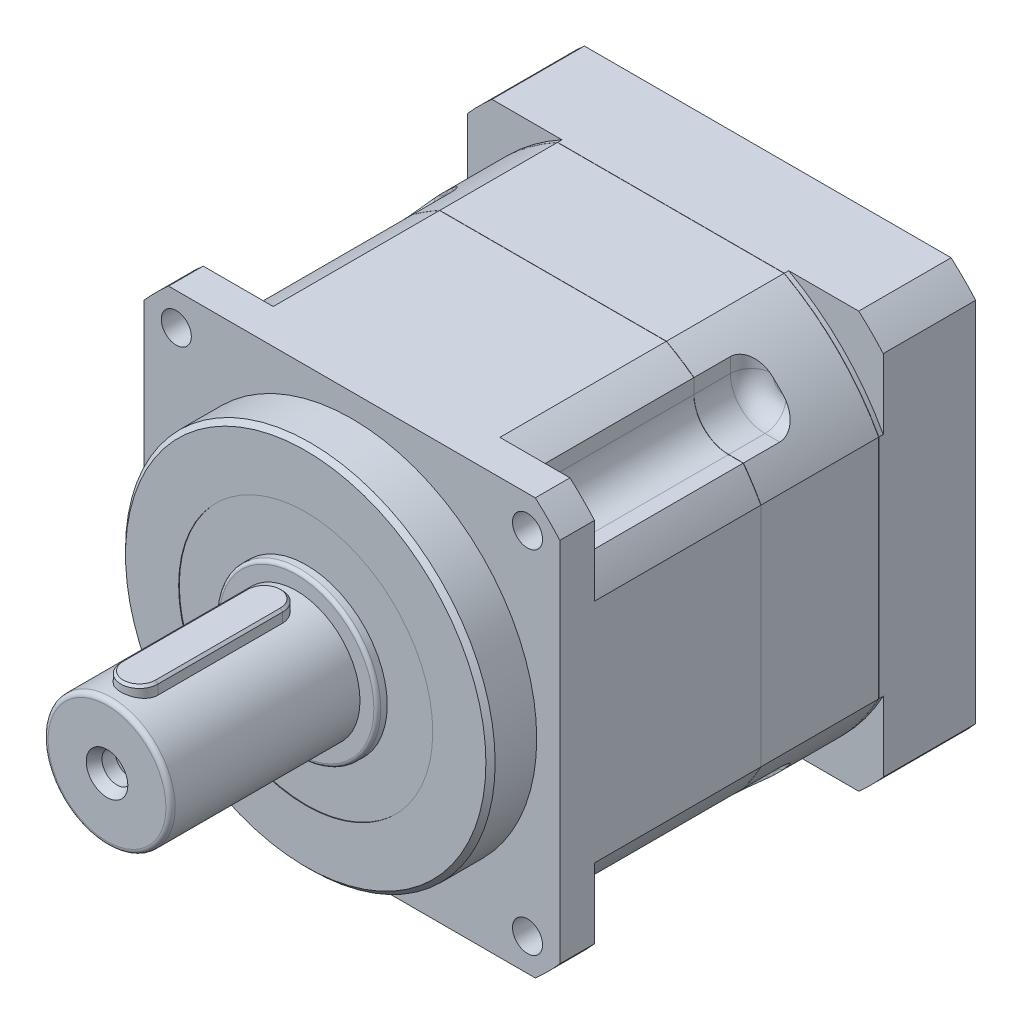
SolidWorks part; units mm, degrees
ref_plane "前视基准面" through (0, 0, 0) normal (0, 0, 1) x (1, 0, 0)
ref_plane "上视基准面" through (0, 0, 0) normal (0, 1, 0) x (1, 0, 0)
ref_plane "右视基准面" through (0, 0, 0) normal (1, 0, 0) x (0, 0, -1)
sketch "草图1" plane through (0, 0, 0) normal (0, 0, 1) x (1, 0, 0)
  line L1 (-79.3725, 90) -> (79.3725, 90)
  line L2 (-90, 79.3725) -> (-90, -79.3725)
  line L3 (-79.3725, -90) -> (79.3725, -90)
  line L4 (90, 79.3725) -> (90, -79.3725)
  arc A0 (-79.3725, 90) -> (-90, 79.3725) centre (0, 0) ccw
  arc A1 (90, 79.3725) -> (79.3725, 90) centre (0, 0) ccw
  arc A2 (79.3725, -90) -> (90, -79.3725) centre (0, 0) ccw
  arc A3 (-90, -79.3725) -> (-79.3725, -90) centre (0, 0) ccw
  dimension "D1" = 90
  dimension "D3" = 90
extrude "凸台-拉伸1" add sketch "草图1" along normal blind 15
sketch "草图2" plane through (0, 0, 15) normal (0, 0, 1) x (1, 0, 0)
  circle A0 centre (0, 0) radius 80
extrude "凸台-拉伸2" add sketch "草图2" along normal blind 20
sketch "草图3" plane through (0, 0, 0) normal (0, 0, -1) x (-1, 0, 0)
  line L0 (-79.3725, 90) -> (79.3725, 90) construction
  line L1 (90, 79.3725) -> (90, -79.3725) construction
  line L2 (79.3725, -90) -> (-79.3725, -90) construction
  line L3 (-90, -79.3725) -> (-90, 79.3725) construction
  line L4 (-49.0535, 90) -> (49.0535, 90)
  line L5 (90, 49.0535) -> (90, -49.0535)
  line L6 (49.0535, -90) -> (-49.0535, -90)
  line L7 (-90, -49.0535) -> (-90, 49.0535)
  arc A0 (-49.0535, 90) -> (-90, 49.0535) centre (0, 0) ccw
  arc A1 (-90, -49.0535) -> (-49.0535, -90) centre (0, 0) ccw
  arc A2 (49.0535, -90) -> (90, -49.0535) centre (0, 0) ccw
  arc A3 (90, 49.0535) -> (49.0535, 90) centre (0, 0) ccw
extrude "凸台-拉伸3" add sketch "草图3" along normal blind 72
sketch "草图4" plane through (0, 0, -72) normal (0, 0, -1) x (-1, 0, 0)
  line L1 (-104.8113, 97.2781) -> (-61, 97.2781)
  line L2 (-104.8113, 97.2781) -> (-104.8113, 61)
  line L3 (-104.8113, 61) -> (-61, 61)
  line L4 (-61, 97.2781) -> (-61, 61)
  dimension "D1" = 61
  dimension "D2" = 61
extrude "切除-拉伸1" cut sketch "草图4" against normal up to surface (72 mm away)
pattern_circular "阵列(圆周)1" count 4 over 360 about axis through (0, 0, 0) along (0, 0, 1) of "切除-拉伸1"
fillet "圆角1" radius 15 4 edges at (61, -61, -36) (-61, -61, -36) (-61, 61, -36) (61, 61, -36)
ref_plane "基准面1" through (0, 0, -72.1) normal (0, 0, -1) x (-1, 0, 0)
sketch "草图5" plane through (0, 0, -72.1) normal (0, 0, -1) x (-1, 0, 0)
  line L1 (-49.0535, 90) -> (49.0535, 90)
  line L2 (-90, 49.0535) -> (-90, -49.0535)
  line L3 (-49.0535, -90) -> (49.0535, -90)
  line L4 (90, 49.0535) -> (90, -49.0535)
  arc A0 (-49.0535, 90) -> (-90, 49.0535) centre (0, 0) ccw
  arc A1 (-90, -49.0535) -> (-49.0535, -90) centre (0, 0) ccw
  arc A2 (49.0535, -90) -> (90, -49.0535) centre (0, 0) ccw
  arc A3 (90, 49.0535) -> (49.0535, 90) centre (0, 0) ccw
  dimension "D1" = 90
  dimension "D3" = 90
extrude "凸台-拉伸4" add sketch "草图5" along normal blind 50.9 separate body
sketch "草图7" plane through (0, 0, -72.1) normal (0, 0, 1) x (1, 0, 0)
  line L0 (61, 76) -> (61, 82.3726) construction
  line L1 (82.3726, 61) -> (76, 61) construction
  line L2 (61, 76) -> (61, 82.3726)
  line L3 (82.3726, 61) -> (76, 61)
  arc A0 (61, 76) -> (76, 61) centre (76, 76) ccw construction
  arc A1 (61, 76) -> (76, 61) centre (76, 76) ccw
  arc A2 (82.3726, 61) -> (61, 82.3726) centre (0, 0) ccw
extrude "切除-拉伸2" cut sketch "草图7" against normal blind 24.9
pattern_circular "阵列(圆周)2" count 4 over 360 about axis through (0, 0, 0) along (0, 0, 1) of "切除-拉伸2"
fillet "圆角2" radius 9.2 12 edges at (79.1863, -61, -97) (61, -79.1863, -97) (-61, -79.1863, -97) (-79.1863, -61, -97) (-79.1863, 61, -97) (-61, 79.1863, -97) (61, 79.1863, -97) (79.1863, 61, -97) (65.3934, -65.3934, -97) (-65.3934, -65.3934, -97) (-65.3934, 65.3934, -97) (65.3934, 65.3934, -97)
ref_plane "基准面2" through (0, 0, -123.1) normal (0, 0, -1) x (-1, 0, 0)
sketch "草图8" plane through (0, 0, -123.1) normal (0, 0, -1) x (-1, 0, 0)
  line L0 (49.0535, 90) -> (-49.0535, 90) construction
  line L1 (-90, 49.0535) -> (-90, -49.0535) construction
  line L2 (-49.0535, -90) -> (49.0535, -90) construction
  line L3 (90, -49.0535) -> (90, 49.0535) construction
  line L4 (49.0535, 90) -> (-49.0535, 90)
  line L5 (-90, 49.0535) -> (-90, -49.0535)
  line L6 (-49.0535, -90) -> (49.0535, -90)
  line L7 (90, -49.0535) -> (90, 49.0535)
  arc A0 (90, 49.0535) -> (49.0535, 90) centre (0, 0) ccw construction
  arc A1 (-49.0535, 90) -> (-90, 49.0535) centre (0, 0) ccw construction
  arc A2 (-90, -49.0535) -> (-49.0535, -90) centre (0, 0) ccw construction
  arc A3 (49.0535, -90) -> (90, -49.0535) centre (0, 0) ccw construction
  arc A4 (90, 49.0535) -> (49.0535, 90) centre (0, 0) ccw
  arc A5 (-49.0535, 90) -> (-90, 49.0535) centre (0, 0) ccw
  arc A6 (-90, -49.0535) -> (-49.0535, -90) centre (0, 0) ccw
  arc A7 (49.0535, -90) -> (90, -49.0535) centre (0, 0) ccw
extrude "凸台-拉伸5" add sketch "草图8" along normal blind 1.9 separate body
sketch "草图9" plane through (0, 0, -125) normal (0, 0, -1) x (-1, 0, 0)
  line L1 (-79.3725, 90) -> (79.3725, 90)
  line L2 (-90, 79.3725) -> (-90, -79.3725)
  line L3 (-79.3725, -90) -> (79.3725, -90)
  line L4 (90, 79.3725) -> (90, -79.3725)
  arc A0 (-79.3725, 90) -> (-90, 79.3725) centre (0, 0) ccw
  arc A1 (-90, -79.3725) -> (-79.3725, -90) centre (0, 0) ccw
  arc A2 (79.3725, -90) -> (90, -79.3725) centre (0, 0) ccw
  arc A3 (90, 79.3725) -> (79.3725, 90) centre (0, 0) ccw
  dimension "D1" = 90
  dimension "D3" = 90
extrude "凸台-拉伸6" add sketch "草图9" along normal blind 40
ref_plane "基准面3" through (-90, 79.3725, -165) normal (0, 1, 0) x (-1, 0, 0)
sketch "草图11" plane through (0, 0, -165) normal (0, 0, -1) x (-1, 0, 0)
  circle A0 centre (0, 0) radius 57.15
extrude "切除-拉伸3" cut sketch "草图11" against normal blind 7
sketch "草图12" plane through (0, 0, -158) normal (0, 0, -1) x (-1, 0, 0)
  circle A0 centre (0, 0) radius 56.5
extrude "切除-拉伸4" cut sketch "草图12" against normal blind 23
sketch "草图13" plane through (0, 0, -165) normal (0, 0, -1) x (-1, 0, 0)
  line L0 (0, 0) -> (-74, 0) construction
  circle A0 centre (0, 0) radius 74 construction
  circle A1 centre (-74, 0) radius 10
extrude "切除-拉伸5" cut sketch "草图13" against normal blind 25
pattern_circular "阵列(圆周)3" count 6 over 360 about axis through (0, 0, 0) along (0, 0, 1) of "切除-拉伸5"
sketch "草图14" plane through (0, 0, -165) normal (0, 0, -1) x (-1, 0, 0)
  line L0 (0, 0) -> (-84.8528, 84.8528) construction
  circle A0 centre (0, 0) radius 100 construction
  arc A1 (-79.3725, 90) -> (-90, 79.3725) centre (0, 0) ccw construction
hole_wizard "M12 螺纹孔1" positions "3D草图1" profile "草图15" tap size "M12" standard "GB"
sketch3d "3D草图1"
  line L0 (0, 0, -165) -> (84.8528, 84.8528, -165) construction
  circle A0 centre (0, 0, -165) radius 100 construction
  point P0 (70.7107, 70.7107, -165)
  point P6 (0, 0, -265)
sketch "草图15" plane through (70.7107, 70.7107, -165) normal (1, 0, 0) x (0, 1, 0)
  line L0 (0, 0) -> (0, 41.0644)
  line L1 (0, 41.0644) -> (5.1, 38)
  line L2 (5.1, 38) -> (5.1, 0)
  line L5 (5.1, 0) -> (0, 0)
  line L10 (0, 41.0644) -> (-5.1, 38) construction
  line L11 (0, -6.35) -> (0, 107.95) construction
  dimension "螺纹孔钻头直径" = 10.2
  dimension "螺纹孔钻头深度" = 38
  dimension "导头角度" = 118
pattern_circular "阵列(圆周)4" count 4 over 360 about axis through (0, 0, 0) along (0, 0, 1) of "M12 螺纹孔1"
ref_plane "基准面4" through (0, 0, -156) normal (0, 0, -1) x (-1, 0, 0)
sketch "草图16" plane through (0, 0, -156) normal (0, 0, -1) x (-1, 0, 0)
  circle A0 centre (0, 0) radius 48
extrude "凸台-拉伸7" add sketch "草图16" against normal up to surface (21 mm away)
chamfer "倒角1" distance 2 angle 45 1 edges at (-48, 0, -156)
sketch "草图17" plane through (0, 0, -165) normal (0, 0, -1) x (-1, 0, 0)
  circle A0 centre (0, 0) radius 21
extrude "切除-拉伸6" cut sketch "草图17" against normal blind 85
sketch "草图18" plane through (0, 0, -156) normal (0, 0, -1) x (-1, 0, 0)
  line L1 (-52.3045, 0.5) -> (51.9702, 0.5)
  line L2 (-52.3045, 0.5) -> (-52.3045, -0.5)
  line L3 (-52.3045, -0.5) -> (51.9702, -0.5)
  line L4 (51.9702, 0.5) -> (51.9702, -0.5)
  dimension "D1" = 0.5
  dimension "D2" = 1
extrude "切除-拉伸7" cut sketch "草图18" against normal up to surface (21 mm away)
sketch "草图19" plane through (0, 0, -140) normal (0, 0, -1) x (-1, 0, 0)
  line L1 (-72.124, 3.4168) -> (-76.021, 3.3331)
  line L2 (-76.021, 3.3331) -> (-77.8971, -0.0837)
  line L3 (-77.8971, -0.0837) -> (-75.876, -3.4168)
  line L4 (-75.876, -3.4168) -> (-71.979, -3.3331)
  line L5 (-71.979, -3.3331) -> (-70.1029, 0.0837)
  line L6 (-70.1029, 0.0837) -> (-72.124, 3.4168)
  circle A0 centre (-74, 0) radius 7.5
  circle A1 centre (-74, 0) radius 3.3757 construction
extrude "凸台-拉伸8" add sketch "草图19" along normal blind 10
pattern_circular "阵列(圆周)5" count 6 over 360 about axis through (0, 0, 0) along (0, 0, 1) of "凸台-拉伸8"
chamfer "倒角2" distance 2 angle 45 1 edges at (80, 0, 35)
sketch "草图20" plane through (0, 0, 15) normal (0, 0, 1) x (1, 0, 0)
  line L0 (0, 0) -> (-84.8528, 84.8528) construction
  circle A0 centre (0, 0) radius 107.5 construction
  arc A1 (-79.3725, 90) -> (-90, 79.3725) centre (0, 0) ccw construction
  circle A2 centre (-76.014, 76.014) radius 6.5
extrude "切除-拉伸8" cut sketch "草图20" against normal up to surface (15 mm away)
pattern_circular "阵列(圆周)6" count 4 over 360 about axis through (0, 0, 0) along (0, 0, 1) of "切除-拉伸8"
sketch "草图21" plane through (0, 0, 35) normal (0, 0, 1) x (1, 0, 0)
  circle A0 centre (0, 0) radius 35
extrude "凸台-拉伸9" add sketch "草图21" along normal blind 4
fillet "圆角3" radius 1.5 1 edges at (35, 0, 39)
sketch "草图22" plane through (0, 0, 39) normal (0, 0, 1) x (1, 0, 0)
  circle A0 centre (0, 0) radius 27.5
extrude "凸台-拉伸10" add sketch "草图22" along normal blind 82
fillet "圆角4" radius 2 1 edges at (27.5, 0, 121)
sketch "草图23" plane through (0, 0, 0) normal (0, 1, 0) x (1, 0, 0)
  line L0 (-25.5, -121) -> (25.5, -121) construction
  line L1 (-8, -53) -> (-8, -107)
  line L2 (8, -53) -> (8, -107)
  arc A0 (-8, -107) -> (8, -107) centre (0, -107) ccw
  arc A1 (8, -53) -> (-8, -53) centre (0, -53) ccw
  dimension "D1" = 14
  dimension "D2" = 54
extrude "凸台-拉伸11" add sketch "草图23" along normal blind 31.5
chamfer "倒角3" distance 1 angle 45 4 edges at (-8, 31.5, 80) (0, 31.5, 115) (0, 31.5, 45) (8, 31.5, 80)
sketch "草图24" plane through (0, 0, 35) normal (0, 0, 1) x (1, 0, 0)
  circle A0 centre (0, 0) radius 55
  circle A1 centre (0, 0) radius 35
extrude "切除-拉伸9" cut sketch "草图24" against normal blind 0.3
sketch "草图25" plane through (0, 0, 121) normal (0, 0, 1) x (1, 0, 0)
  circle A0 centre (0, 0) radius 6.5
extrude "切除-拉伸10" cut sketch "草图25" against normal blind 10
ref_plane "基准面5" through (0, 0, 116.7) normal (0, 0, 1) x (1, 0, 0)
sketch "草图26" plane through (0, 0, 121) normal (0, 0, 1) x (1, 0, 0)
  circle A0 centre (0, 0) radius 9
sketch "草图27" plane through (0, 0, 116.7) normal (0, 0, 1) x (1, 0, 0)
  circle A0 centre (0, 0) radius 6.5 construction
  circle A1 centre (0, 0) radius 6.5
loft "切除-放样1" cut profiles "草图26", "草图27"
hole_wizard "M12 螺纹孔2" positions "3D草图2" profile "草图28" tap size "M12" standard "GB"
sketch3d "3D草图2"
  line L0 (0, 0, 111) -> (0, 0, 116.7) construction
  point P0 (0, 0, 111)
sketch "草图28" plane through (0, 0, 111) normal (1, 0, 0) x (0, -1, 0)
  line L0 (0, 0) -> (0, 38.0644)
  line L1 (0, 38.0644) -> (5.1, 35)
  line L2 (5.1, 35) -> (5.1, 0)
  line L5 (5.1, 0) -> (0, 0)
  line L10 (0, 38.0644) -> (-5.1, 35) construction
  line L11 (0, -6.35) -> (0, 107.95) construction
  dimension "螺纹孔钻头直径" = 10.2
  dimension "螺纹孔钻头深度" = 35
  dimension "导头角度" = 118
